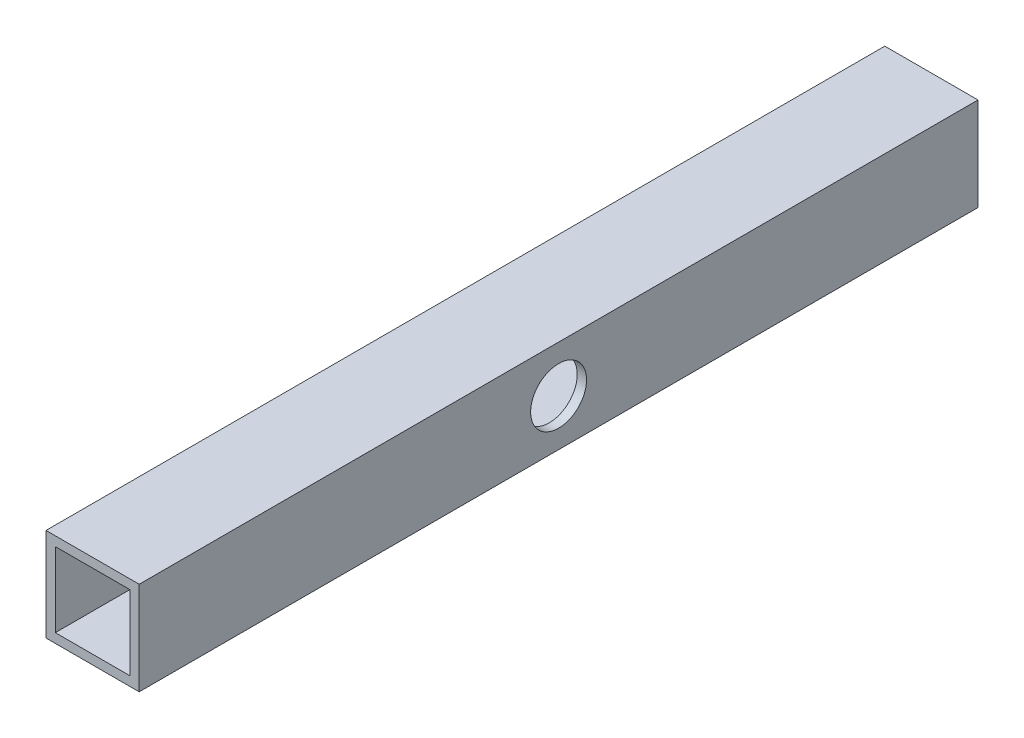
SolidWorks part; units mm, degrees
ref_plane "Plan de face" through (0, 0, 0) normal (0, 0, 1) x (1, 0, 0)
ref_plane "Plan de dessus" through (0, 0, 0) normal (0, 1, 0) x (1, 0, 0)
ref_plane "Plan de droite" through (0, 0, 0) normal (1, 0, 0) x (0, 0, -1)
sketch "Esquisse1" plane through (0, 0, 0) normal (0, 0, 1) x (1, 0, 0)
  line L0 (-5, 45) -> (-45, 45)
  line L1 (0, 0) -> (-50, 0)
  line L2 (0, 0) -> (0, 50)
  line L3 (0, 50) -> (-50, 50)
  line L4 (-50, 0) -> (-50, 50)
  line L5 (-45, 5) -> (-45, 45)
  line L6 (-5, 5) -> (-45, 5)
  line L7 (-5, 5) -> (-5, 45)
  dimension "D1" = 50
  dimension "D2" = 50
  dimension "D3" = 5
extrude "Boss.-Extru.1" add sketch "Esquisse1" along normal blind 450
sketch "Esquisse2" plane through (0, 0, 0) normal (1, 0, 0) x (0, 0, -1)
  circle A0 centre (-225, 25) radius 15
  dimension "D1" = 30
extrude "Enlèv. mat.-Extru.1" cut sketch "Esquisse2" against normal blind 79
